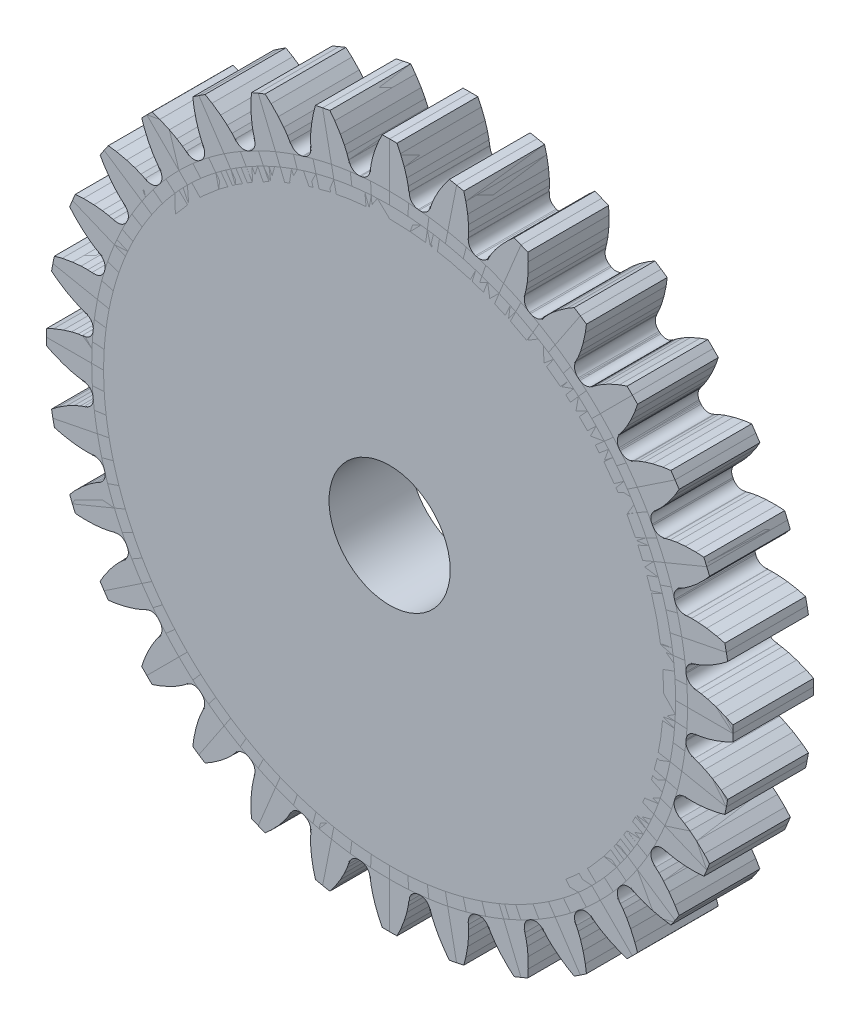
SolidWorks part; units mm, degrees
ref_plane "Face" through (0, 0, 0) normal (0, 0, 1) x (1, 0, 0)
ref_plane "Dessus" through (0, 0, 0) normal (0, 1, 0) x (1, 0, 0)
ref_plane "Droite" through (0, 0, 0) normal (1, 0, 0) x (0, 0, -1)
imported_body "Importée1"
sketch "Esquisse1" plane through (0, 0, 0) normal (0, 0, 1) x (1, 0, 0)
  circle A0 centre (0, 0) radius 6.785
  circle A1 centre (0, 0) radius 1.5
  circle A2 centre (0, 0) radius 6.785 construction
  dimension "D1" = 3
extrude "Boss.-Extru.1" add sketch "Esquisse1" against normal blind 2
